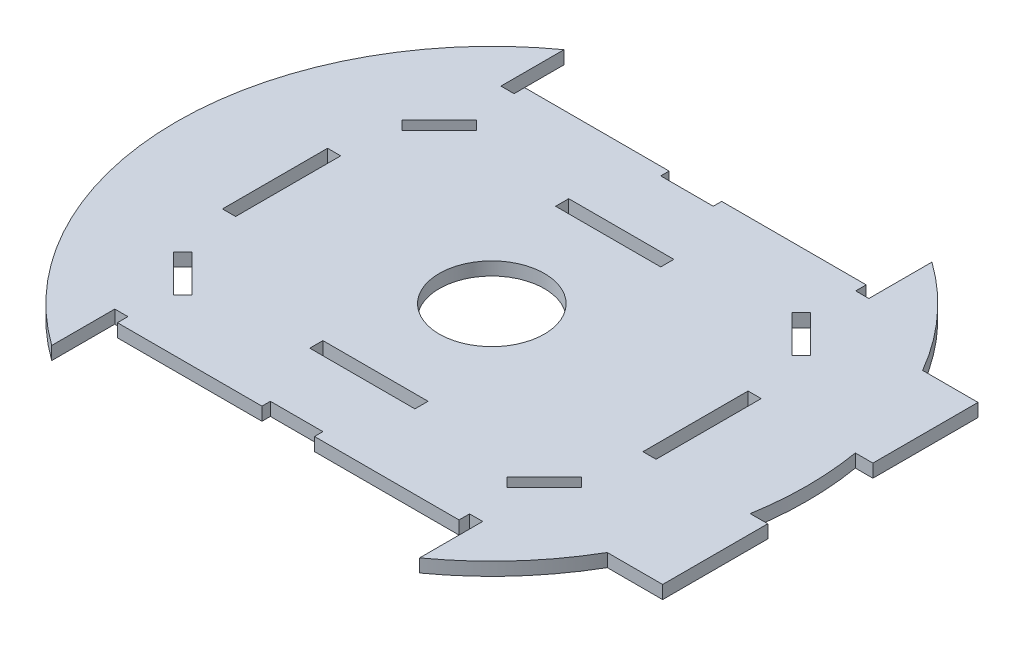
SolidWorks part; units mm, degrees
ref_plane "Front Plane" through (0, 0, 0) normal (0, 0, 1) x (1, 0, 0)
ref_plane "Top Plane" through (0, 0, 0) normal (0, 1, 0) x (1, 0, 0)
ref_plane "Right Plane" through (0, 0, 0) normal (1, 0, 0) x (0, 0, -1)
sketch "Sketch1" plane through (0, 0, 0) normal (0, 1, 0) x (1, 0, 0)
  circle A0 centre (0, 0) radius 76.2
  dimension "D1" = 152.4
extrude "Extrude1" add sketch "Sketch1" along normal mid plane 3.175
sketch "Sketch7" plane through (0, 1.5875, 0) normal (0, 1, 0) x (1, 0, 0)
  line L1 (49.2125, 12.7) -> (52.3875, 12.7)
  line L2 (49.2125, 12.7) -> (49.2125, -12.7)
  line L3 (49.2125, -12.7) -> (52.3875, -12.7)
  line L4 (52.3875, 12.7) -> (52.3875, -12.7)
  line L5 (49.2125, 12.7) -> (52.3875, -12.7) construction
  line L6 (49.2125, -12.7) -> (52.3875, 12.7) construction
  line L9 (-52.3875, 12.7) -> (-49.2125, 12.7)
  line L10 (-52.3875, 12.7) -> (-52.3875, -12.7)
  line L11 (-52.3875, -12.7) -> (-49.2125, -12.7)
  line L12 (-49.2125, 12.7) -> (-49.2125, -12.7)
  line L13 (-52.3875, 12.7) -> (-49.2125, -12.7) construction
  line L14 (-52.3875, -12.7) -> (-49.2125, 12.7) construction
  point P0 (50.8, 0)
  point P10 (-50.8, 0)
  dimension "D1" = 50.8
  dimension "D2" = 3.175
  dimension "D3" = 50.8
  dimension "D4" = 3.175
  dimension "D5" = 25.4
  dimension "D6" = 25.4
extrude "Cut-Extrude2" cut sketch "Sketch7" against normal through all
sketch "Sketch8" plane through (0, 1.5875, 0) normal (0, 1, 0) x (-1, 0, 0)
  line L0 (0, -82.2722) -> (0, 84.1701) construction
  line L1 (44.45, 61.8921) -> (44.45, 49.1921)
  line L2 (44.45, 49.1921) -> (0, 49.1921)
  line L3 (-44.45, 49.1921) -> (-44.45, 61.8921)
  line L4 (44.45, 61.8921) -> (0, 99.9921)
  line L5 (0, 99.9921) -> (-44.45, 61.8921)
  line L6 (0, 49.1921) -> (-44.45, 49.1921)
  line L7 (92.8701, 0) -> (-110.8252, 0) construction
  line L8 (0, -49.1921) -> (-44.45, -49.1921)
  line L9 (0, -99.9921) -> (-44.45, -61.8921)
  line L10 (44.45, -61.8921) -> (0, -99.9921)
  line L11 (-44.45, -49.1921) -> (-44.45, -61.8921)
  line L12 (44.45, -49.1921) -> (0, -49.1921)
  line L13 (44.45, -61.8921) -> (44.45, -49.1921)
  circle A0 centre (0, 0) radius 76.2 construction
  dimension "D1" = 12.7
  dimension "D2" = 44.45
  dimension "D3" = 38.1
extrude "Cut-Extrude3" cut sketch "Sketch8" against normal through all
sketch "Sketch9" plane through (0, 1.5875, 0) normal (0, 1, 0) x (1, 0, 0)
  line L0 (-6.35, -49.1921) -> (-6.35, -47.1601)
  line L1 (44.45, -49.1921) -> (-44.45, -49.1921) construction
  line L2 (-6.35, -47.1601) -> (0, -47.1601)
  line L3 (0, -47.1601) -> (6.35, -47.1601)
  line L4 (6.35, -47.1601) -> (6.35, -49.1921)
  line L5 (6.35, -49.1921) -> (-6.35, -49.1921)
  line L6 (-82.5475, 0) -> (82.3934, 0) construction
  line L7 (6.35, 49.1921) -> (-6.35, 49.1921)
  line L8 (6.35, 47.1601) -> (6.35, 49.1921)
  line L9 (0, 47.1601) -> (6.35, 47.1601)
  line L10 (-6.35, 47.1601) -> (0, 47.1601)
  line L11 (-6.35, 49.1921) -> (-6.35, 47.1601)
  dimension "D1" = 6.35
  dimension "D2" = 2.032
extrude "Cut-Extrude4" cut sketch "Sketch9" against normal through all
sketch "Sketch10" plane through (0, 1.5875, 0) normal (0, 1, 0) x (1, 0, 0)
  line L0 (6.35, -47.1601) -> (-6.35, -47.1601) construction
  line L1 (-12.7, -28.1101) -> (12.7, -28.1101)
  line L2 (-12.7, -28.1101) -> (-12.7, -31.2851)
  line L3 (-12.7, -31.2851) -> (12.7, -31.2851)
  line L4 (12.7, -28.1101) -> (12.7, -31.2851)
  line L5 (-12.7, -28.1101) -> (12.7, -31.2851) construction
  line L6 (-12.7, -31.2851) -> (12.7, -28.1101) construction
  line L7 (-85.4764, 0) -> (84.3973, 0) construction
  line L8 (-12.7, 31.2851) -> (12.7, 28.1101) construction
  line L9 (-12.7, 28.1101) -> (12.7, 31.2851) construction
  line L10 (12.7, 28.1101) -> (12.7, 31.2851)
  line L11 (-12.7, 31.2851) -> (12.7, 31.2851)
  line L12 (-12.7, 28.1101) -> (-12.7, 31.2851)
  line L13 (-12.7, 28.1101) -> (12.7, 28.1101)
  point P0 (0, -29.6976)
  point P14 (0, 29.6976)
  dimension "D1" = 25.4
  dimension "D2" = 3.175
  dimension "D3" = 19.05
extrude "Cut-Extrude5" cut sketch "Sketch10" against normal through all
sketch "Sketch12" plane through (0, 1.5875, 0) normal (0, 1, 0) x (1, 0, 0)
  line L0 (-40.3451, 36.6253) -> (-49.3253, 27.6451)
  line L1 (-40.3451, 36.6253) -> (-38.1, 34.3803)
  line L2 (-49.3253, 27.6451) -> (-47.0803, 25.4)
  line L3 (-38.1, 34.3803) -> (-47.0803, 25.4)
  line L4 (-92.1049, 0) -> (91.3341, 0) construction
  line L5 (0, 66.0534) -> (0, -68.0574) construction
  line L6 (38.1, 34.3803) -> (47.0803, 25.4)
  line L7 (49.3253, 27.6451) -> (47.0803, 25.4)
  line L8 (40.3451, 36.6253) -> (38.1, 34.3803)
  line L9 (40.3451, 36.6253) -> (49.3253, 27.6451)
  line L10 (40.3451, -36.6253) -> (49.3253, -27.6451)
  line L11 (40.3451, -36.6253) -> (38.1, -34.3803)
  line L12 (49.3253, -27.6451) -> (47.0803, -25.4)
  line L13 (38.1, -34.3803) -> (47.0803, -25.4)
  line L14 (-38.1, -34.3803) -> (-47.0803, -25.4)
  line L15 (-49.3253, -27.6451) -> (-47.0803, -25.4)
  line L16 (-40.3451, -36.6253) -> (-38.1, -34.3803)
  line L17 (-40.3451, -36.6253) -> (-49.3253, -27.6451)
  dimension "D1" = 12.7
  dimension "D2" = 3.175
  dimension "D3" = 45
  dimension "D4" = 25.4
  dimension "D5" = 38.1
sketch "Sketch13" plane through (0, 1.5875, 0) normal (0, 1, 0) x (1, 0, 0)
  line L1 (-26.1938, 17.4625) -> (26.1937, 17.4625) construction
  line L2 (-26.1938, 17.4625) -> (-26.1937, -17.4625) construction
  line L3 (-26.1937, -17.4625) -> (26.1938, -17.4625) construction
  line L4 (26.1937, 17.4625) -> (26.1938, -17.4625) construction
  line L5 (-26.1938, 17.4625) -> (26.1938, -17.4625) construction
  line L6 (-26.1937, -17.4625) -> (26.1937, 17.4625) construction
  point P0 (0, 0)
  dimension "D1" = 34.925
  dimension "D2" = 52.3875
extrude "Cut-Extrude6" cut sketch "Sketch12" against normal through all
sketch "Sketch14" plane through (0, 1.5875, 0) normal (0, 1, 0) x (1, 0, 0)
  line L0 (0, 63.4912) -> (0, -67.2032) construction
  line L1 (-44.45, -49.1921) -> (-41.275, -49.1921)
  line L2 (-44.45, -49.1921) -> (-44.45, -46.6521)
  line L3 (-44.45, -46.6521) -> (-41.275, -46.6521)
  line L4 (-41.275, -49.1921) -> (-41.275, -46.6521)
  line L5 (41.275, -49.1921) -> (41.275, -46.6521)
  line L6 (44.45, -46.6521) -> (41.275, -46.6521)
  line L7 (44.45, -49.1921) -> (44.45, -46.6521)
  line L8 (44.45, -49.1921) -> (41.275, -49.1921)
  line L9 (-83.7527, 0) -> (86.8461, 0) construction
  line L10 (44.45, 49.1921) -> (41.275, 49.1921)
  line L11 (44.45, 49.1921) -> (44.45, 46.6521)
  line L12 (44.45, 46.6521) -> (41.275, 46.6521)
  line L13 (41.275, 49.1921) -> (41.275, 46.6521)
  line L14 (-41.275, 49.1921) -> (-41.275, 46.6521)
  line L15 (-44.45, 46.6521) -> (-41.275, 46.6521)
  line L16 (-44.45, 49.1921) -> (-44.45, 46.6521)
  line L17 (-44.45, 49.1921) -> (-41.275, 49.1921)
  dimension "D1" = 3.175
  dimension "D2" = 2.54
extrude "Cut-Extrude7" cut sketch "Sketch14" against normal through all
sketch "Sketch17" plane through (0, 1.5875, 0) normal (0, 1, 0) x (1, 0, 0)
  circle A0 centre (0, 0) radius 12.7
  dimension "D1" = 25.4
extrude "Cut-Extrude8" cut sketch "Sketch17" against normal through all
sketch "Sketch18" plane through (0, 1.5875, 0) normal (0, 1, 0) x (1, 0, 0)
  line L0 (-88.0698, 0) -> (105.4509, 0) construction
  line L1 (65.9911, -38.1) -> (79.375, -38.1)
  line L2 (65.9911, -38.1) -> (65.9911, -12.7)
  line L3 (65.9911, -12.7) -> (79.375, -12.7)
  line L4 (79.375, -38.1) -> (79.375, -12.7)
  line L5 (79.375, 38.1) -> (79.375, 12.7)
  line L6 (65.9911, 12.7) -> (79.375, 12.7)
  line L7 (65.9911, 38.1) -> (65.9911, 12.7)
  line L8 (65.9911, 38.1) -> (79.375, 38.1)
  arc A0 (44.45, -61.8921) -> (44.45, 61.8921) centre (0, 0) ccw construction
  arc A1 (44.45, -61.8921) -> (44.45, 61.8921) centre (0, 0) ccw construction
  point P7 (76.2, 0)
  dimension "D1" = 25.4
  dimension "D2" = 3.175
  dimension "D3" = 12.7
extrude "Boss-Extrude1" add sketch "Sketch18" against normal through all
